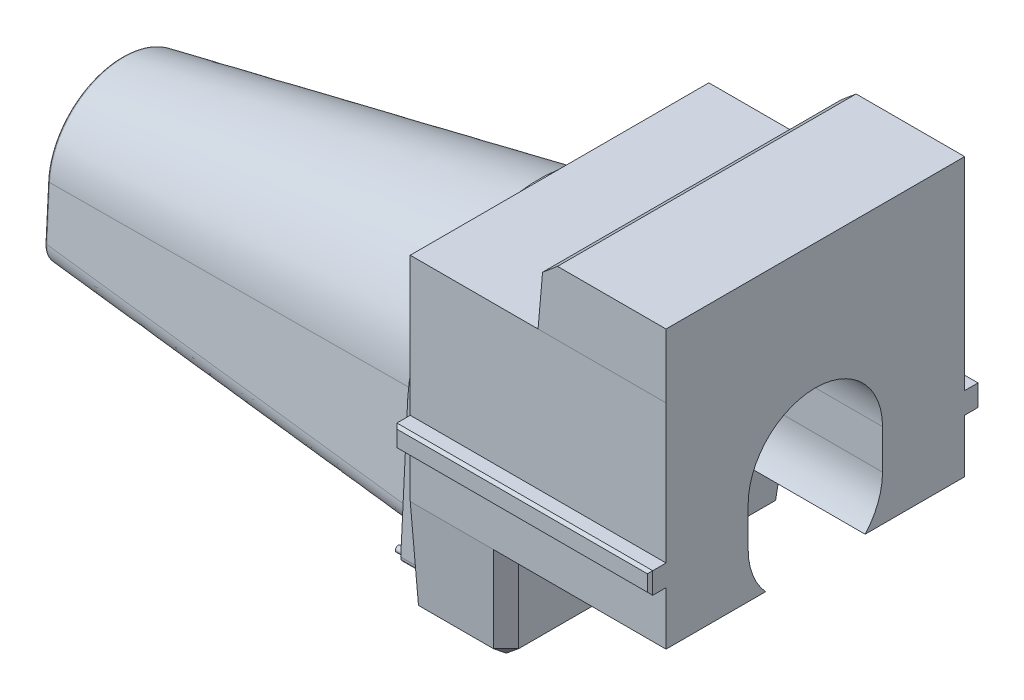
SolidWorks part; units mm, degrees
ref_plane "Front Plane" through (0, 0, 0) normal (0, 0, 1) x (1, 0, 0)
ref_plane "Top Plane" through (0, 0, 0) normal (0, 1, 0) x (1, 0, 0)
ref_plane "Right Plane" through (0, 0, 0) normal (1, 0, 0) x (0, 0, -1)
sketch "Sketch1" plane through (0, 0, 0) normal (1, 0, 0) x (0, 0, -1)
  line L0 (0, 0) -> (0, 139.7) construction
  line L2 (-177.8, 330.2) -> (177.8, 330.2)
  line L3 (-177.8, 330.2) -> (-177.8, -50.8)
  line L4 (-177.8, -50.8) -> (177.8, -50.8)
  line L5 (177.8, 330.2) -> (177.8, -50.8)
  line L6 (-177.8, 330.2) -> (177.8, -50.8) construction
  line L7 (-177.8, -50.8) -> (177.8, 330.2) construction
  dimension "D1" = 50.8
  dimension "D2" = 330.2
  dimension "D3" = 355.6
extrude "Boss-Extrude1" add sketch "Sketch1" along normal blind 825.4
other "Cavity1"
other "die_demo_2020-2<3>@die_demo-a2"
sketch "Sketch2" plane through (0, 8, 0) normal (0, -1, 0) x (1, 0, 0)
  line L1 (90.696, -63.1972) -> (380.2544, -63.1972)
  line L2 (90.696, -63.1972) -> (90.696, 71.4154)
  line L3 (90.696, 71.4154) -> (380.2544, 71.4154)
  line L4 (380.2544, -63.1972) -> (380.2544, 71.4154)
extrude "Cut-Extrude1" cut sketch "Sketch2" along normal blind 40
sketch "Sketch3" plane through (825.4, 0, 0) normal (1, 0, 0) x (0, 0, -1)
  line L0 (-177.8, 76.2) -> (-166.6889, -50.8)
  line L1 (-177.8, 330.2) -> (-177.8, -50.8) construction
  line L2 (-177.8, -50.8) -> (177.8, -50.8) construction
  line L3 (-166.6889, -50.8) -> (-177.8, -50.8)
  line L4 (-177.8, -50.8) -> (-177.8, 76.2)
  line L5 (177.8, 76.2) -> (177.8, -50.8)
  line L6 (177.8, -50.8) -> (177.8, 330.2) construction
  line L7 (177.8, -50.8) -> (166.6889, -50.8)
  line L8 (166.6889, -50.8) -> (177.8, 76.2)
  line L9 (177.8, 76.2) -> (-177.8, 76.2) construction
  dimension "D1" = 127
  dimension "D2" = 5
  dimension "D3" = 5
extrude "Cut-Extrude6" cut sketch "Sketch3" against normal through all
sketch "Sketch4" plane through (0, 0, 177.8) normal (0, 0, 1) x (1, 0, 0)
  line L0 (634.9, 76.2) -> (623.7889, -50.8)
  line L2 (623.7889, -50.8) -> (825.4, -50.8)
  line L3 (825.4, -50.8) -> (825.4, 76.2)
  line L4 (825.4, 76.2) -> (634.9, 76.2)
  line L7 (825.4, 330.2) -> (825.4, 76.2) construction
  line L8 (825.4, 330.2) -> (825.4, 76.2) construction
  dimension "D1" = 5
  dimension "D2" = 127
  dimension "D3" = 190.5
extrude "Cut-Extrude3" cut sketch "Sketch4" against normal up to surface (355.6 mm away)
sketch "Sketch8" plane through (496, 0, 0) normal (-1, 0, 0) x (0, 0, 1)
  line L1 (-331.7427, -456.934) -> (331.7427, -456.934)
  line L2 (-331.7427, -456.934) -> (-331.7427, 446.934)
  line L3 (-331.7427, 446.934) -> (331.7427, 446.934)
  line L4 (331.7427, -456.934) -> (331.7427, 446.934)
  line L5 (164.0436, -2.7613) -> (164.3338, 0)
  line L6 (164.3338, 0) -> (155.9918, 159.1752)
  line L7 (-155.9918, 159.1752) -> (-164.3338, 0)
  line L8 (-164.3338, 0) -> (-164.0436, -2.7613)
  line L9 (-161.5573, -5) -> (161.5573, -5)
  line L10 (164.0436, -2.7613) -> (164.3338, 0)
  line L11 (164.3338, 0) -> (155.9918, 159.1752)
  line L12 (-155.9918, 159.1752) -> (-164.3338, 0)
  line L13 (-164.3338, 0) -> (-164.0436, -2.7613)
  line L14 (-161.5573, -5) -> (161.5573, -5)
  line L15 (-331.7427, -456.934) -> (331.7427, 446.934) construction
  line L16 (-331.7427, 446.934) -> (331.7427, -456.934) construction
  arc A3 (155.9918, 159.1752) -> (-155.9918, 159.1752) centre (0, 151) ccw
  arc A4 (-164.0436, -2.7613) -> (-161.5573, -5) centre (-161.5573, -2.5) ccw
  arc A5 (161.5573, -5) -> (164.0436, -2.7613) centre (161.5573, -2.5) ccw
  arc A6 (155.9918, 159.1752) -> (-155.9918, 159.1752) centre (0, 151) ccw
  arc A7 (-164.0436, -2.7613) -> (-161.5573, -5) centre (-161.5573, -2.5) ccw
  arc A8 (161.5573, -5) -> (164.0436, -2.7613) centre (161.5573, -2.5) ccw
  point P4 (0, -5)
  dimension "D1" = 0
extrude "Cut-Extrude7" cut sketch "Sketch8" along normal blind 2
sketch "Sketch9" plane through (496, 0, 0) normal (-1, 0, 0) x (0, 0, 1)
  line L1 (-294.5144, 394.7575) -> (294.5144, 394.7575)
  line L2 (-294.5144, 394.7575) -> (-294.5144, -92.7575)
  line L3 (-294.5144, -92.7575) -> (294.5144, -92.7575)
  line L4 (294.5144, 394.7575) -> (294.5144, -92.7575)
  line L5 (164.0436, -2.7613) -> (164.3338, 0)
  line L6 (164.3338, 0) -> (155.9918, 159.1752)
  line L7 (-155.9918, 159.1752) -> (-164.3338, 0)
  line L8 (-164.3338, 0) -> (-164.0436, -2.7613)
  line L9 (-161.5573, -5) -> (161.5573, -5)
  line L10 (164.0436, -2.7613) -> (164.3338, 0)
  line L11 (164.3338, 0) -> (155.9918, 159.1752)
  line L12 (-155.9918, 159.1752) -> (-164.3338, 0)
  line L13 (-164.3338, 0) -> (-164.0436, -2.7613)
  line L14 (-161.5573, -5) -> (161.5573, -5)
  line L15 (-294.5144, 394.7575) -> (294.5144, -92.7575) construction
  line L16 (-294.5144, -92.7575) -> (294.5144, 394.7575) construction
  arc A3 (161.5573, -5) -> (164.0436, -2.7613) centre (161.5573, -2.5) ccw
  arc A4 (155.9918, 159.1752) -> (-155.9918, 159.1752) centre (0, 151) ccw
  arc A5 (-164.0436, -2.7613) -> (-161.5573, -5) centre (-161.5573, -2.5) ccw
  arc A6 (161.5573, -5) -> (164.0436, -2.7613) centre (161.5573, -2.5) ccw
  arc A7 (155.9918, 159.1752) -> (-155.9918, 159.1752) centre (0, 151) ccw
  arc A8 (-164.0436, -2.7613) -> (-161.5573, -5) centre (-161.5573, -2.5) ccw
  dimension "D1" = 0
extrude "Cut-Extrude8" cut sketch "Sketch9" against normal blind 24.8
delete or keep bodies "Body-Delete/Keep 1" type delete bodies bodies 120
sketch "Sketch5" plane through (825.4, 0, 0) normal (1, 0, 0) x (0, 0, -1)
  line L0 (0, 0) -> (0, 166.1092) construction
  line L1 (0, 73.6387) -> (0, 115.6372) construction
  line L2 (-47.9367, 73.6387) -> (-47.9367, 115.6372)
  line L3 (47.9367, 73.6387) -> (47.9367, 115.6372)
  line L4 (-62.3373, 11) -> (62.3373, 11)
  line L5 (-62.3373, 11) -> (62.3373, 11) construction
  line L6 (-86.2141, 101.6991) -> (-89.4789, 39.4038)
  line L13 (-86.2141, 101.6991) -> (-89.4789, 39.4038) construction
  line L14 (89.4789, 39.4038) -> (86.2141, 101.6991)
  line L15 (89.4789, 39.4038) -> (86.2141, 101.6991) construction
  arc A0 (-47.9367, 73.6387) -> (47.9367, 73.6387) centre (0, 73.6387) ccw
  arc A1 (47.9367, 115.6372) -> (-47.9367, 115.6372) centre (0, 115.6372) ccw
  ellipse E1 centre (62.3373, 38) end of major axis (89.5156, 38) minor radius 27 (62.3373, 11) -> (89.4789, 39.4038) ccw
  ellipse E2 centre (62.3373, 38) end of major axis (89.5156, 38) minor radius 27 (62.3373, 11) -> (89.4789, 39.4038) ccw construction
  spline S2 degree 3 poles (2848.408, 614.322) (581.0489, 315.0074) (-106.4043, 145.5103) (-89.0626, 33.0057) (-88.8744, 32.0976) (-88.4094, 30.3201) (-87.8566, 28.5784) (-87.1325, 26.9063) (-86.3224, 25.2692) (-85.8733, 24.4666) (-84.398, 22.1228) (-83.2723, 20.6864) (-81.3792, 18.7133) (-80.7138, 18.0861) (-79.6628, 17.1922) (-79.3026, 16.9013) (-78.5717, 16.3412) (-78.2005, 16.0715) (-76.3164, 14.7737) (-74.72, 13.8962) (-72.6133, 13.0001) (-72.1863, 12.831) (-71.3209, 12.5135) (-70.8829, 12.3653) (-69.5664, 11.9566) (-68.681, 11.7302) (32.0045, -8.7456) (226.2676, 526.4128) (732.8115, 2897.6678) knots -7.561498 -7.561498 -7.561498 -7.561498 0.125 0.125 0.1875 0.1875 0.25 0.3125 0.3125 0.375 0.375 0.5 0.5 0.5625 0.5625 0.59375 0.59375 0.625 0.625 0.75 0.75 0.78125 0.78125 0.8125 0.8125 0.875 0.875 7.858714 7.858714 7.858714 7.858714 only from (-89.4789, 39.4038) to (-62.3373, 11)
  spline S3 degree 3 poles (-89.4789, 39.4038) (-89.5756, 37.5581) (-89.4822, 35.7279) (-89.0626, 33.0057) (-88.8744, 32.0976) (-88.4094, 30.3201) (-87.8566, 28.5784) (-87.1325, 26.9063) (-86.3224, 25.2692) (-85.8733, 24.4666) (-84.398, 22.1228) (-83.2723, 20.6864) (-81.3792, 18.7133) (-80.7138, 18.0861) (-79.6628, 17.1922) (-79.3026, 16.9013) (-78.5717, 16.3412) (-78.2005, 16.0715) (-76.3164, 14.7737) (-74.72, 13.8962) (-72.6133, 13.0001) (-72.1863, 12.831) (-71.3209, 12.5135) (-70.8829, 12.3653) (-69.5664, 11.9566) (-68.681, 11.7302) (-66.0017, 11.1853) (-64.1853, 11) (-62.3373, 11) knots 0 0 0 0 0.125 0.125 0.1875 0.1875 0.25 0.3125 0.3125 0.375 0.375 0.5 0.5 0.5625 0.5625 0.59375 0.59375 0.625 0.625 0.75 0.75 0.78125 0.78125 0.8125 0.8125 0.875 0.875 1 1 1 1 construction
  spline S4 degree 3 number of poles 77 (86.2141, 101.6991) -> (-86.2141, 101.6991)
  spline S5 degree 3 number of poles 77 (86.2141, 101.6991) -> (-86.2141, 101.6991) construction
  point P17 (0, 94.6379)
  dimension "D1" = 0
extrude "Cut-Extrude4" cut sketch "Sketch5" against normal blind 766
sketch "Sketch6" plane through (825.4, 0, 0) normal (1, 0, 0) x (0, 0, -1)
  line L0 (0, 0) -> (0, 293.2061) construction
  line L1 (0, 129.9289) -> (0, 176.8512) construction
  line L2 (-79.9997, 129.9289) -> (-79.9997, 176.8512)
  line L3 (79.9997, 129.9289) -> (79.9997, 176.8512)
  arc A0 (-79.9997, 129.9289) -> (79.9997, 129.9289) centre (0, 129.9289) ccw
  arc A1 (79.9997, 176.8512) -> (-79.9997, 176.8512) centre (0, 176.8512) ccw
  point P7 (0, 153.3901)
extrude "Cut-Extrude5" cut sketch "Sketch6" against normal blind 400
fillet "Fillet1" radius 30 5 edges at (425.4, 93.7154, -71.3339) (425.4, 153.3901, -79.9997) (425.4, 93.7154, 71.3339) (425.4, 153.3901, 79.9997) (425.4, 256.8509, 0)
fillet "Fillet2" radius 30 4 edges at (59.4, 94.6379, 47.9367) (59.4, 163.5739, 0) (59.4, 94.6379, -47.9367) (59.4, 25.702, 0)
chamfer "Chamfer1" distance 15 angle 45 5 edges at (623.7889, -50.8, 0) (629.3445, 12.7, -172.2445) (629.3445, 12.7, 172.2445) (572.2945, -50.8, -166.6889) (572.2945, -50.8, 166.6889)
sketch "Sketch7" plane through (0, 0, 177.8) normal (0, 0, 1) x (1, 0, 0)
  line L0 (673, 330.2) -> (679.6666, 406.4)
  line L1 (825.4, 330.2) -> (520.8, 330.2) construction
  line L2 (679.6666, 406.4) -> (825.4, 406.4)
  line L3 (825.4, 406.4) -> (825.4, 330.2)
  line L4 (825.4, 330.2) -> (673, 330.2)
  dimension "D1" = 85
  dimension "D2" = 76.2
  dimension "D3" = 152.4
extrude "Boss-Extrude2" add sketch "Sketch7" against normal up to surface (355.6 mm away)
chamfer "Chamfer2" distance 15 angle 45 1 edges at (679.6666, 406.4, 0)
sketch "Sketch11" plane through (0, 0, 177.8) normal (0, 0, 1) x (1, 0, 0)
  line L0 (673, 330.2) -> (825.4, 330.2)
  line L1 (825.4, 406.4) -> (825.4, 76.2) construction
sketch "Sketch12" plane through (825.4, 0, 0) normal (1, 0, 0) x (0, 0, -1)
  line L0 (-177.8, 330.2) -> (-177.8, 76.2) construction
  line L1 (-177.8, 165.1) -> (-196.85, 165.1)
  line L2 (-177.8, 165.1) -> (-177.8, 139.7)
  line L3 (-177.8, 139.7) -> (-196.85, 139.7)
  line L4 (-196.85, 165.1) -> (-196.85, 139.7)
  line L5 (177.8, 76.2) -> (177.8, 330.2) construction
  line L6 (177.8, 165.1) -> (196.85, 165.1)
  line L7 (177.8, 165.1) -> (177.8, 139.7)
  line L8 (177.8, 139.7) -> (196.85, 139.7)
  line L9 (196.85, 165.1) -> (196.85, 139.7)
  line L10 (-59.2718, 76.2) -> (-177.8, 76.2) construction
  dimension "D1" = 63.5
  dimension "D2" = 19.05
  dimension "D3" = 25.4
extrude "Boss-Extrude3" add sketch "Sketch12" against normal up to surface (304.6 mm away)
chamfer "Chamfer3" distance 3.175 angle 45 8 edges at (520.8, 152.4, -196.85) (825.4, 152.4, -196.85) (673.1, 165.1, -196.85) (673.1, 139.7, -196.85) (520.8, 152.4, 196.85) (825.4, 152.4, 196.85) (673.1, 139.7, 196.85) (673.1, 165.1, 196.85)
ref_plane "Plane1" through (0, 0, 88.9) normal (0, 0, 1) x (1, 0, 0)
sketch "Sketch13" plane through (0, 0, 88.9) normal (0, 0, 1) x (1, 0, 0)
  line L0 (634.9, 76.2) -> (625.0963, -35.8571)
  line L1 (634.9, 76.2) -> (625.0963, -35.8571) construction
  line L2 (825.4, 76.2) -> (634.9, 76.2)
  line L3 (825.4, 76.2) -> (634.9, 76.2) construction
  line L4 (634.9, 76.2) -> (160.6535, 117.6912) construction
  line L5 (634.9, 76.2) -> (635.2825, 76.2) construction
  line L7 (633.2397, 57.2225) -> (634.9, 76.2)
  line L8 (635.2825, 76.2) -> (634.9029, 76.2332)
  line L9 (634.9029, 76.2332) -> (634.9, 76.2)
  arc A0 (635.2825, 76.2) -> (633.2397, 57.2225) centre (160.6535, 117.6912) cw
  dimension "D1" = 0.381
  dimension "D2" = 19.05
revolve "Revolve2" add sketch "Sketch13" angle 180 mid plane about L8
